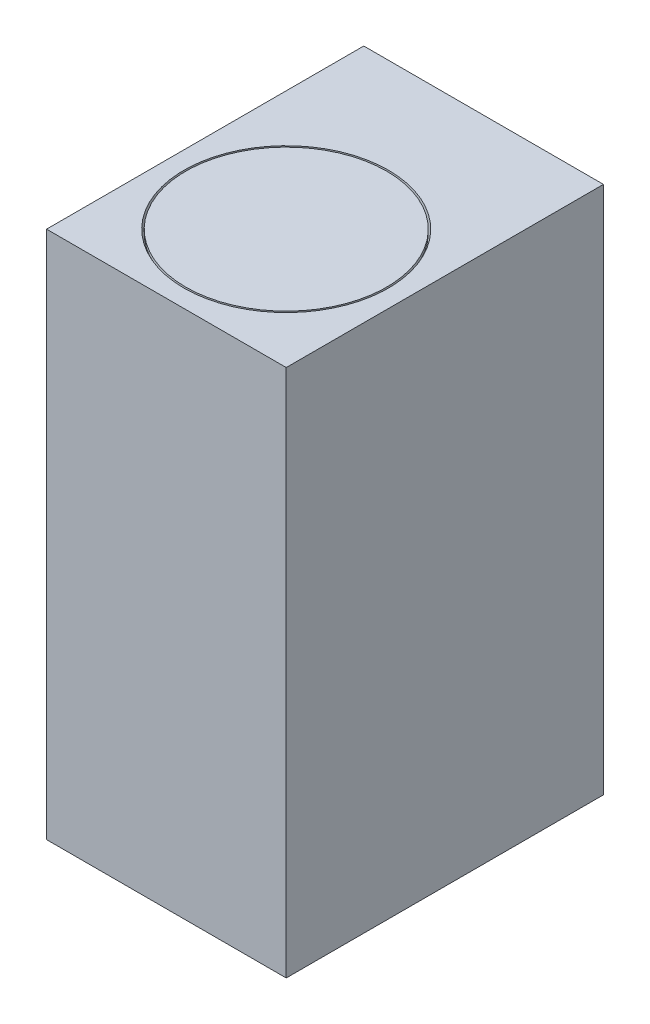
SolidWorks part; units mm, degrees
ref_plane "Alzado" through (0, 0, 0) normal (0, 0, 1) x (1, 0, 0)
ref_plane "Planta" through (0, 0, 0) normal (0, 1, 0) x (1, 0, 0)
ref_plane "Vista lateral" through (0, 0, 0) normal (1, 0, 0) x (0, 0, -1)
sketch "Croquis1" plane through (0, 0, 0) normal (0, 0, 1) x (1, 0, 0)
  line L0 (0, 0) -> (0, 150)
  line L1 (0, 150) -> (68, 150)
  line L2 (68, 150) -> (68, 0)
  line L3 (68, 0) -> (0, 0)
  dimension "D1" = 150
  dimension "D2" = 68
extrude "Saliente-Extruir1" add sketch "Croquis1" along normal blind 90
sketch "Croquis2" plane through (0, 150, 0) normal (0, 1, 0) x (1, 0, 0)
  line L0 (34, -90) -> (34, 0) construction
  line L1 (68, -90) -> (0, -90) construction
  line L2 (68, 0) -> (0, 0) construction
  circle A0 centre (34, -56) radius 29
  dimension "D2" = 58
  dimension "D1" = 34
extrude "Cortar-Extruir1" cut sketch "Croquis2" against normal blind 90
sketch "Croquis3" plane through (0, 60, 0) normal (0, 1, 0) x (1, 0, 0)
  circle A0 centre (34, -56) radius 28
extrude "Saliente-Extruir2" add sketch "Croquis3" along normal blind 85
sketch "Croquis4" plane through (0, 150, 0) normal (0, 1, 0) x (1, 0, 0)
  circle A0 centre (34, -56) radius 28.5
extrude "Saliente-Extruir3" add sketch "Croquis4" against normal blind 1 separate body
